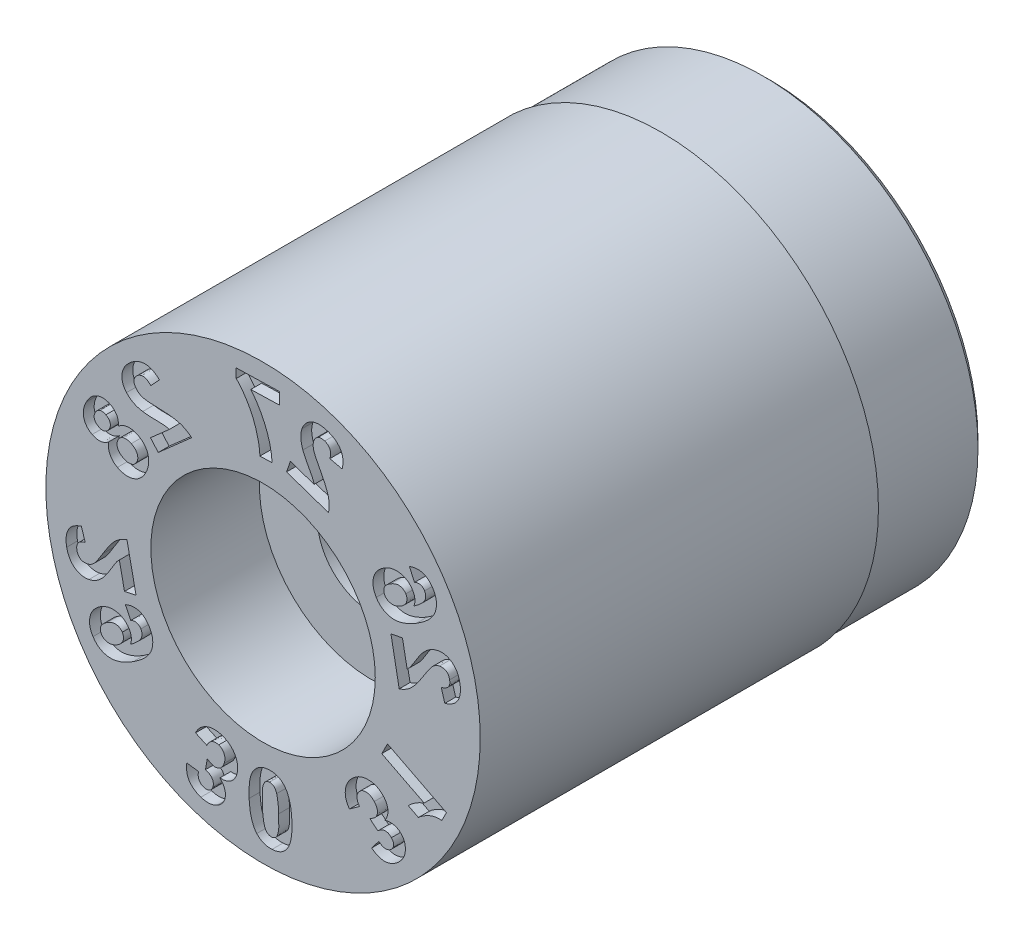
SolidWorks part; units mm, degrees
ref_plane "Front Plane" through (0, 0, 0) normal (0, 0, 1) x (1, 0, 0)
ref_plane "Top Plane" through (0, 0, 0) normal (0, 1, 0) x (1, 0, 0)
ref_plane "Right Plane" through (0, 0, 0) normal (1, 0, 0) x (0, 0, -1)
sketch "Sketch1" plane through (0, 0, 0) normal (1, 0, 0) x (0, 0, -1)
  line L2 (0, 6) -> (0, 3.1)
  line L3 (13.75, 6) -> (0, 6)
  line L4 (-3.7979, 0) -> (49996.2021, 0) construction
  line L8 (14, 1.5) -> (3, 1.5)
  line L9 (3, 3.1) -> (3, 1.5)
  line L10 (3, 3.1) -> (0, 3.1)
  line L12 (14, 1.5) -> (14, 5.75)
  line L16 (14, 5.75) -> (13.75, 6)
  dimension "D1" = 14
  dimension "D2" = 45
  dimension "D3" = 0.25
  dimension "D4" = 12
  dimension "D5" = 6.2
  dimension "D6" = 3
  dimension "D7" = 3
revolve "Revolve1" add sketch "Sketch1" angle 360 about L4
sketch "Sketch4" plane through (0, 0, 0) normal (1, 0, 0) x (0, 0, -1)
  line L0 (0, 0) -> (50000, 0) construction
  line L1 (14, -5.75) -> (14, 5.75) construction
  line L2 (11, 6.935) -> (14, 6.935)
  line L3 (11, 6.935) -> (11, 5.935)
  line L4 (11, 5.935) -> (14, 5.935)
  line L5 (14, 6.935) -> (14, 5.935)
  line L6 (13.75, 6) -> (0, 6) construction
  line L9 (0, 6.6) -> (0, -6.6) construction
  dimension "D1" = 1
  dimension "D2" = 0.065
  dimension "D3" = 11
revolve "Cut-Revolve1" cut sketch "Sketch4" angle 360 about L0
sketch "Sketch5" plane through (0, 0, 0) normal (0, 0, 1) x (1, 0, 0)
  circle A0 centre (0, 0) radius 3.7731 construction
  text T0 "26  27  28  29  30  31" font "Arial" height 1.84
  dimension "D1" = 7.5461
extrude "Cut-Extrude1" cut sketch "Sketch5" against normal blind 0.3
